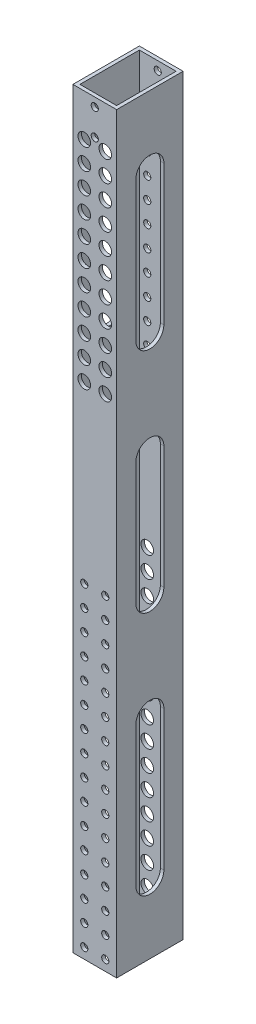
SolidWorks part; units mm, degrees
ref_plane "前视基准面" through (0, 0, 0) normal (0, 0, 1) x (1, 0, 0)
ref_plane "上视基准面" through (0, 0, 0) normal (0, 1, 0) x (1, 0, 0)
ref_plane "右视基准面" through (0, 0, 0) normal (1, 0, 0) x (0, 0, -1)
sketch "草图1" plane through (0, 0, 0) normal (0, 1, 0) x (1, 0, 0)
  line L1 (-10.5, 17) -> (10.5, 17)
  line L2 (-10.5, 17) -> (-10.5, -17)
  line L3 (-10.5, -17) -> (10.5, -17)
  line L4 (10.5, 17) -> (10.5, -17)
  line L5 (-10.5, 17) -> (10.5, -17) construction
  line L6 (-10.5, -17) -> (10.5, 17) construction
  line L7 (-12.5, 19) -> (12.5, 19)
  line L8 (-12.5, 19) -> (-12.5, -19)
  line L9 (-12.5, -19) -> (12.5, -19)
  line L10 (12.5, 19) -> (12.5, -19)
  line L11 (-12.5, 19) -> (12.5, -19) construction
  line L12 (-12.5, -19) -> (12.5, 19) construction
  point P0 (0, 0)
  point P6 (0, 0)
  dimension "D1" = 21
  dimension "D2" = 34
  dimension "D3" = 25
  dimension "D4" = 38
extrude "凸台-拉伸1" add sketch "草图1" along normal mid plane 430
sketch "草图2" plane through (0, 0, 19) normal (0, 0, 1) x (1, 0, 0)
  line L0 (0, 215) -> (0, -106.5806) construction
  line L1 (-12.5, 215) -> (12.5, 215) construction
  line L2 (-12.5, 0) -> (44.2261, 0) construction
  line L3 (-12.5, 215) -> (-12.5, -215) construction
  circle A0 centre (0, 195) radius 2.05
  circle A2 centre (0, 210) radius 2.05
  dimension "D1" = 4.1
  dimension "D3" = 4.1
  dimension "D4" = 15
  dimension "D2" = 5
extrude "切除-拉伸1" cut sketch "草图2" against normal blind 300
sketch "草图3" plane through (-12.5, 0, 0) normal (-1, 0, 0) x (0, 0, 1)
  line L0 (0, 84) -> (0, -84) construction
  line L2 (-19, 0) -> (66.1704, 0) construction
  line L3 (-19, 215) -> (-19, -215) construction
  line L4 (0, -96) -> (0, -104) construction
  line L5 (0, -116) -> (0, -206.1692) construction
  circle A3 centre (0, 35) radius 8
  circle A10 centre (0, -35) radius 8
  dimension "D1" = 16
  dimension "D2" = 70
extrude "切除-拉伸2" cut sketch "草图3" against normal through all
sketch "草图4" plane through (0, 0, 19) normal (0, 0, 1) x (1, 0, 0)
  line L0 (0, 215) -> (0, 102) construction
  line L1 (-12.5, 215) -> (12.5, 215) construction
  line L2 (-59.9208, 0) -> (48.7614, 0) construction
  line L3 (0, 90) -> (0, 84) construction
  line L4 (0, -102) -> (0, -202.5662) construction
  line L5 (0, 72) -> (0, -72) construction
  line L6 (0, -84) -> (0, -90) construction
  circle A3 centre (0, 60) radius 6
  circle A4 centre (0, 20) radius 6
  circle A5 centre (0, -20) radius 6
  circle A6 centre (0, -60) radius 6
  dimension "D2" = 12
  dimension "D6" = 20
  dimension "D7" = 60
extrude "切除-拉伸3" [suppressed] cut sketch "草图4" against normal through all
sketch "草图5" plane through (12.5, 0, 0) normal (1, 0, 0) x (0, 0, -1)
  line L0 (-8, 35) -> (-8, -35)
  line L1 (8, 35) -> (8, -35)
  circle A0 centre (0, 35) radius 8 construction
  circle A1 centre (0, -35) radius 8 construction
  arc A2 (8, 35) -> (-8, 35) centre (0, 35) ccw
  arc A3 (-8, -35) -> (8, -35) centre (0, -35) ccw
extrude "切除-拉伸4" cut sketch "草图5" against normal blind 38
sketch "草图8" plane through (0, 0, 19) normal (0, 0, 1) x (1, 0, 0)
  line L0 (0, -215) -> (0, -179.2055) construction
  line L1 (-12.5, -215) -> (12.5, -215) construction
  circle A0 centre (-6, -209) radius 2.05
  circle A1 centre (6, -209) radius 2.05
  circle A2 centre (-6, -197) radius 2.05
  circle A3 centre (6, -197) radius 2.05
  circle A4 centre (-6, -185) radius 2.05
  circle A5 centre (6, -185) radius 2.05
  circle A6 centre (-6, -173) radius 2.05
  circle A7 centre (6, -173) radius 2.05
  circle A8 centre (-6, -161) radius 2.05
  circle A9 centre (6, -161) radius 2.05
  circle A10 centre (-6, -149) radius 2.05
  circle A11 centre (6, -149) radius 2.05
  circle A12 centre (-6, -137) radius 2.05
  circle A13 centre (6, -137) radius 2.05
  circle A14 centre (-6, -125) radius 2.05
  circle A15 centre (6, -125) radius 2.05
  circle A16 centre (-6, -113) radius 2.05
  circle A17 centre (6, -113) radius 2.05
  circle A18 centre (-6, -101) radius 2.05
  circle A19 centre (6, -101) radius 2.05
  circle A20 centre (-6, -89) radius 2.05
  circle A21 centre (6, -89) radius 2.05
  circle A22 centre (-6, -77) radius 2.05
  circle A23 centre (6, -77) radius 2.05
  circle A24 centre (-6, -65) radius 2.05
  circle A25 centre (6, -65) radius 2.05
  circle A26 centre (-6, -53) radius 2.05
  circle A27 centre (6, -53) radius 2.05
  circle A28 centre (-6, 71) radius 2.05
  circle A29 centre (6, 71) radius 2.05
  circle A30 centre (-6, 83) radius 2.05
  circle A31 centre (6, 83) radius 2.05
  circle A32 centre (-6, 95) radius 2.05
  circle A33 centre (6, 95) radius 2.05
  circle A34 centre (-6, 107) radius 2.05
  circle A35 centre (6, 107) radius 2.05
  circle A36 centre (-6, -41) radius 2.05
  circle A37 centre (6, -41) radius 2.05
  circle A38 centre (-6, -29) radius 2.05
  circle A39 centre (6, -29) radius 2.05
  circle A40 centre (-6, 119) radius 2.05
  circle A41 centre (6, 119) radius 2.05
  circle A42 centre (-6, 131) radius 2.05
  circle A43 centre (6, 131) radius 2.05
  circle A44 centre (-6, 143) radius 2.05
  circle A45 centre (6, 143) radius 2.05
  circle A46 centre (-6, 155) radius 2.05
  circle A47 centre (6, 155) radius 2.05
  circle A48 centre (-6, 167) radius 2.05
  circle A49 centre (6, 167) radius 2.05
  circle A50 centre (-6, 179) radius 2.05
  circle A51 centre (6, 179) radius 2.05
  circle A52 centre (-6, 191) radius 2.05
  circle A53 centre (6, 191) radius 2.05
  dimension "D1" = 4.1
  dimension "D2" = 12
  dimension "D3" = 6
  dimension "D4" = 16
  dimension "D5" = 2
  dimension "D6" = 2
  dimension "D7" = 8
  dimension "D8" = 4
extrude "切除-拉伸7" cut sketch "草图8" against normal blind 67
sketch "草图9" plane through (-12.5, 0, 0) normal (-1, 0, 0) x (0, 0, 1)
  line L0 (0, -215) -> (0, 0) construction
  line L1 (-19, -215) -> (19, -215) construction
  line L2 (0, 175) -> (0, 95) construction
  line L3 (8, 175) -> (8, 95)
  line L4 (-8, 175) -> (-8, 95)
  line L5 (-19, 215) -> (19, 215) construction
  line L6 (0, 0) -> (104.8063, 0) construction
  line L7 (0, -175) -> (0, -95) construction
  line L8 (8, -175) -> (8, -95)
  line L9 (-8, -175) -> (-8, -95)
  arc A0 (8, 175) -> (-8, 175) centre (0, 175) ccw
  arc A1 (-8, 95) -> (8, 95) centre (0, 95) ccw
  arc A2 (8, -175) -> (-8, -175) centre (0, -175) cw
  arc A3 (-8, -95) -> (8, -95) centre (0, -95) cw
  point P7 (0, 135)
  point P17 (0, -135)
  dimension "D1" = 40
  dimension "D3" = 8
  dimension "D2" = 80
extrude "切除-拉伸8" cut sketch "草图9" against normal up to surface (25 mm away)
sketch "草图11" plane through (0, 0, 19) normal (0, 0, 1) x (1, 0, 0)
  circle A0 centre (6, -209) radius 3.6
  circle A1 centre (-6, -209) radius 3.6
  circle A2 centre (-6, -197) radius 3.6
  circle A3 centre (6, -197) radius 3.6
  circle A4 centre (-6, -185) radius 3.6
  circle A5 centre (6, -185) radius 3.6
  circle A6 centre (-6, -173) radius 3.6
  circle A7 centre (6, -173) radius 3.6
  circle A8 centre (-6, -161) radius 3.6
  circle A9 centre (6, -161) radius 3.6
  circle A10 centre (-6, -149) radius 3.6
  circle A11 centre (6, -149) radius 3.6
  circle A12 centre (-6, -137) radius 3.6
  circle A13 centre (6, -137) radius 3.6
  circle A14 centre (-6, -125) radius 3.6
  circle A15 centre (6, -125) radius 3.6
  circle A16 centre (-6, -113) radius 3.6
  circle A17 centre (6, -113) radius 3.6
  circle A18 centre (-6, -101) radius 3.6
  circle A19 centre (6, -101) radius 3.6
  circle A20 centre (-6, -89) radius 3.6
  circle A21 centre (6, -89) radius 3.6
  circle A22 centre (-6, -77) radius 3.6
  circle A23 centre (6, -77) radius 3.6
  circle A24 centre (-6, -65) radius 3.6
  circle A25 centre (6, -65) radius 3.6
  circle A26 centre (-6, -53) radius 3.6
  circle A27 centre (6, -53) radius 3.6
  circle A28 centre (-6, -41) radius 3.6
  circle A29 centre (6, -41) radius 3.6
  circle A30 centre (-6, -29) radius 3.6
  circle A31 centre (6, -29) radius 3.6
  dimension "D1" = 7.2
  dimension "D2" = 16
extrude "切除-拉伸9" cut sketch "草图11" against normal blind 48 from offset 5
sketch "草图12" plane through (0, 0, 19) normal (0, 0, 1) x (1, 0, 0)
  circle A0 centre (-6, 191) radius 3.6
  circle A1 centre (6, 191) radius 3.6
  circle A2 centre (-6, 179) radius 3.6
  circle A3 centre (6, 179) radius 3.6
  circle A4 centre (-6, 167) radius 3.6
  circle A5 centre (6, 167) radius 3.6
  circle A6 centre (-6, 155) radius 3.6
  circle A7 centre (6, 155) radius 3.6
  circle A8 centre (-6, 143) radius 3.6
  circle A9 centre (6, 143) radius 3.6
  circle A10 centre (-6, 131) radius 3.6
  circle A11 centre (6, 131) radius 3.6
  circle A12 centre (-6, 119) radius 3.6
  circle A13 centre (6, 119) radius 3.6
  circle A14 centre (-6, 107) radius 3.6
  circle A15 centre (6, 107) radius 3.6
  circle A16 centre (-6, 95) radius 3.6
  circle A17 centre (6, 95) radius 3.6
  circle A18 centre (-6, 83) radius 3.6
  circle A19 centre (6, 83) radius 3.6
  circle A20 centre (-6, 71) radius 3.6
  circle A21 centre (6, 71) radius 3.6
  dimension "D1" = 7.2
  dimension "D2" = 7.2
  dimension "D3" = 11
extrude "切除-拉伸10" cut sketch "草图12" against normal blind 10
